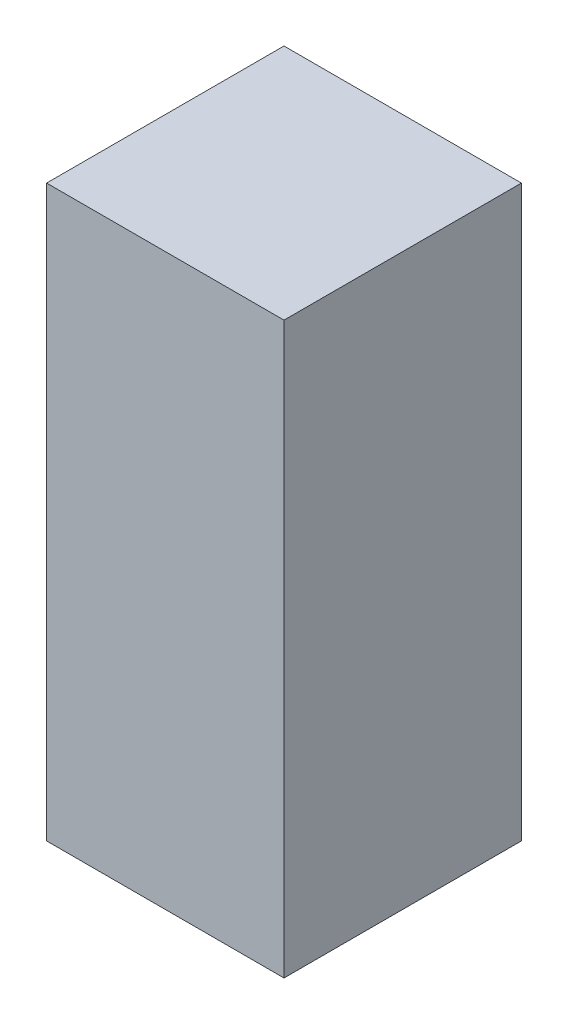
SolidWorks part; units mm, degrees
ref_plane "Front Plane" through (0, 0, 0) normal (0, 0, 1) x (1, 0, 0)
ref_plane "Top Plane" through (0, 0, 0) normal (0, 1, 0) x (1, 0, 0)
ref_plane "Right Plane" through (0, 0, 0) normal (1, 0, 0) x (0, 0, -1)
sketch "Sketch1" plane through (0, 0, 0) normal (0, 1, 0) x (1, 0, 0)
  line L1 (-25, 25) -> (25, 25)
  line L2 (-25, 25) -> (-25, -25)
  line L3 (-25, -25) -> (25, -25)
  line L4 (25, 25) -> (25, -25)
  dimension "D1" = 50
  dimension "D2" = 50
  dimension "D3" = 25
  dimension "D4" = 25
extrude "Extrude1" add sketch "Sketch1" along normal blind 120
ref_plane "Plane2" through (0, 60, 0) normal (0, 1, 0) x (-1, 0, 0)
sketch "Sketch2" plane through (0, 60, 0) normal (0, 1, 0) x (-1, 0, 0)
  line L1 (-25, 25) -> (25, 25)
  line L2 (-25, 25) -> (-25, -25)
  line L3 (-25, -25) -> (25, -25)
  line L4 (25, 25) -> (25, -25)
